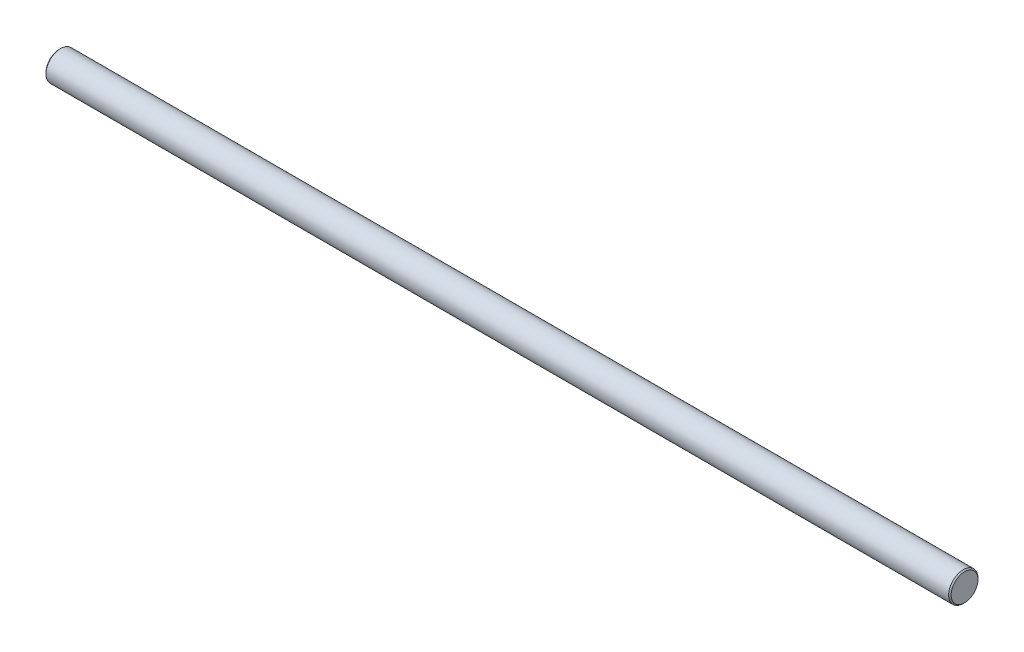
SolidWorks part; units mm, degrees
ref_plane "Спереди" through (0, 0, 0) normal (0, 0, 1) x (1, 0, 0)
ref_plane "Сверху" through (0, 0, 0) normal (0, 1, 0) x (1, 0, 0)
ref_plane "Справа" through (0, 0, 0) normal (1, 0, 0) x (0, 0, -1)
sketch "Эскиз1" plane through (0, 0, 0) normal (1, 0, 0) x (0, 0, -1)
  circle A0 centre (0, 0) radius 3
  dimension "D1" = 6
extrude "Бобышка-Вытянуть1" add sketch "Эскиз1" along normal blind 185
chamfer "Фаска1" distance 0.25 angle 45 2 edges at (0, 0, -3) (185, 0, -3)
